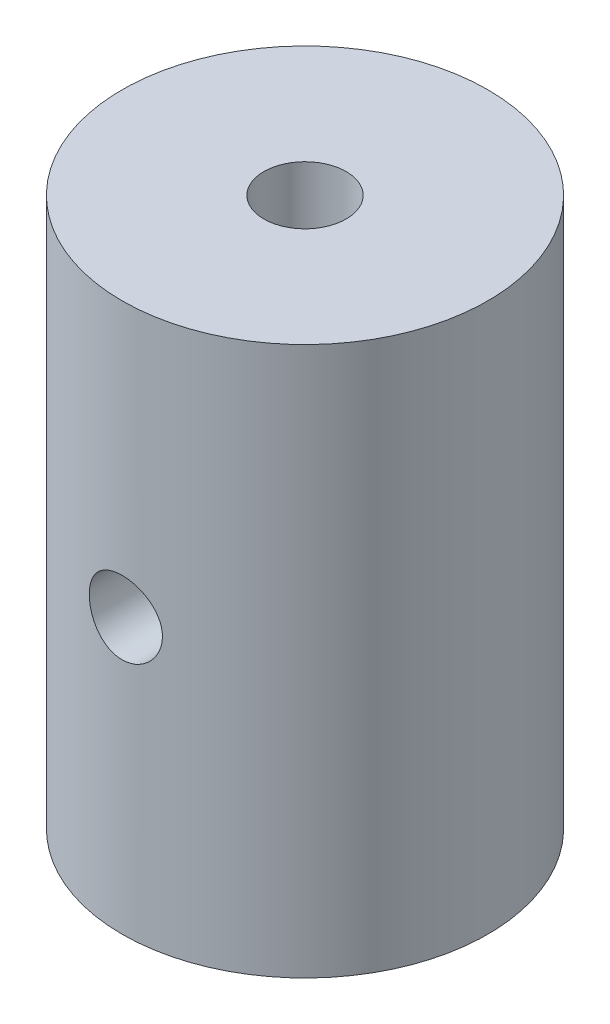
SolidWorks part; units mm, degrees
ref_plane "Front" through (0, 0, 0) normal (0, 0, 1) x (1, 0, 0)
ref_plane "Top" through (0, 0, 0) normal (0, 1, 0) x (1, 0, 0)
ref_plane "Right" through (0, 0, 0) normal (1, 0, 0) x (0, 0, -1)
sketch "Sketch1" plane through (0, 0, 0) normal (0, 1, 0) x (1, 0, 0)
  circle A0 centre (0, 0) radius 10
  circle A1 centre (0, 0) radius 2.25
extrude "Extrude1" add sketch "Sketch1" along normal blind 30
sketch "Sketch2" plane through (0, 0, 0) normal (0, 0, 1) x (1, 0, 0)
  circle A0 centre (0, 15) radius 2
extrude "Cut-Extrude2" cut sketch "Sketch2" along normal blind 30
sketch "Sketch3" plane through (0, 0, 0) normal (0, 0, 1) x (1, 0, 0)
  circle A0 centre (0, 15) radius 1.65
extrude "Cut-Extrude3" cut sketch "Sketch3" against normal blind 30
